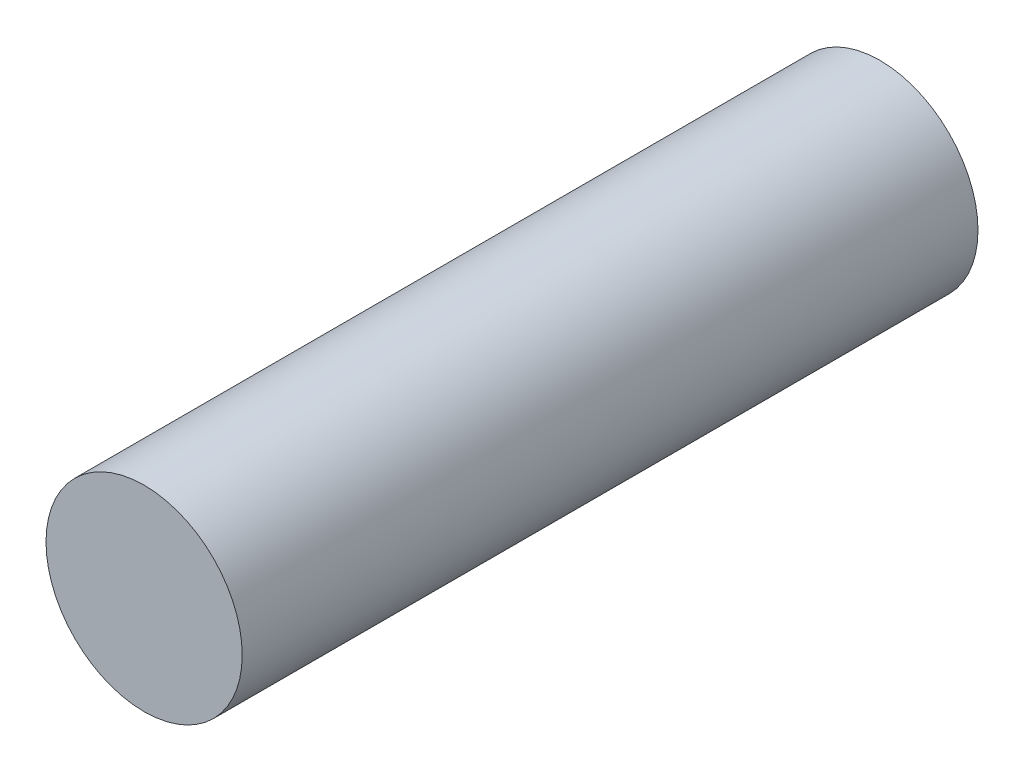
SolidWorks part; units mm, degrees
ref_plane "Front" through (0, 0, 0) normal (0, 0, 1) x (1, 0, 0)
ref_plane "Top" through (0, 0, 0) normal (0, 1, 0) x (1, 0, 0)
ref_plane "Right" through (0, 0, 0) normal (1, 0, 0) x (0, 0, -1)
sketch "Sketch1" plane through (0, 0, 0) normal (0, 0, 1) x (1, 0, 0)
  circle A0 centre (0, 0) radius 10.16
  dimension "D1" = 20.32
extrude "Base-Extrude" add sketch "Sketch1" against normal blind 76.2
